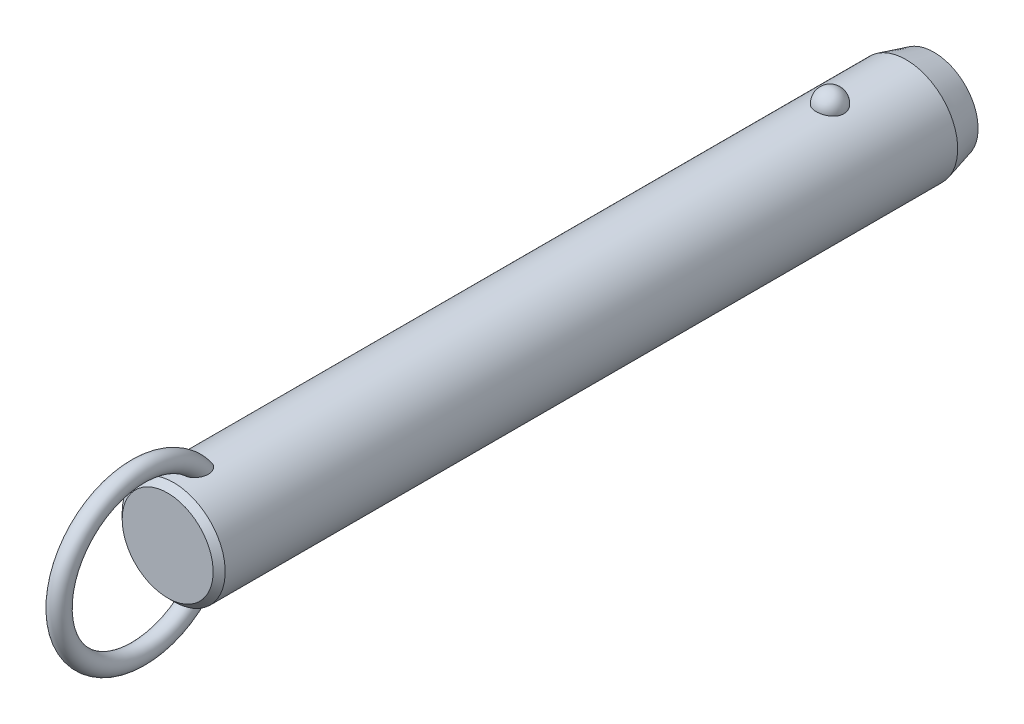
SolidWorks part; units mm, degrees
ref_plane "Front Plane" through (0, 0, 0) normal (0, 0, 1) x (1, 0, 0)
ref_plane "Top Plane" through (0, 0, 0) normal (0, 1, 0) x (1, 0, 0)
ref_plane "Right Plane" through (0, 0, 0) normal (1, 0, 0) x (0, 0, -1)
sketch "Sketch2" plane through (0, 0, 0) normal (0, 0, 1) x (1, 0, 0)
  circle A0 centre (0, 0) radius 11.1
  point P3 (0, 11.1)
  dimension "D1" = 22.2
extrude "Boss-Extrude1" add sketch "Sketch2" along normal blind 127
sketch "Sketch3" plane through (0, 0, 0) normal (0, 0, -1) x (-1, 0, 0)
  circle A0 centre (0, 0) radius 11.1
  dimension "D1" = 22.2
extrude "Boss-Extrude2" add sketch "Sketch3" along normal blind 25.4
chamfer "Chamfer1" distance 6 angle 15 1 edges at (-11.1, 0, -25.4)
sketch "Sketch12" plane through (0, 0, 0) normal (1, 0, 0) x (0, 0, -1)
  line L0 (-127, 11.1) -> (-127, -11.1) construction
  point P0 (-127, 0)
sketch "Sketch13" plane through (0, 0, 0) normal (1, 0, 0) x (0, 0, -1)
  circle A0 centre (-146.05, 0) radius 19.05
  point P2 (-127, 0)
  dimension "D1" = 38.1
sketch "Sketch14" plane through (0, 0, 0) normal (0, 1, 0) x (1, 0, 0)
  circle A0 centre (0, -129) radius 2
  point P2 (0, -127)
  dimension "D1" = 4
sweep "Sweep1" add profiles "Sketch14" path "Sketch13"
sketch "Sketch15" plane through (0, 0, 127) normal (0, 0, 1) x (1, 0, 0)
  circle A0 centre (0, 0) radius 11.1
  dimension "D1" = 22.2
extrude "Boss-Extrude3" add sketch "Sketch15" along normal blind 12.7
chamfer "Chamfer2" distance 1.3 angle 45 1 edges at (11.1, 0, 139.7)
sketch "Sketch18" plane through (0, 0, 0) normal (1, 0, 0) x (0, 0, -1)
  line L0 (19.4, 11.1) -> (-130.568, 11.1) construction
  line L1 (3, 14.1) -> (3, 8.1)
  line L2 (-130.568, -11.1) -> (19.4, -11.1) construction
  arc A0 (3, 14.1) -> (3, 8.1) centre (3, 11.1) ccw
  point P4 (0, 11.1)
  dimension "D1" = 25.2
revolve "Revolve1" add sketch "Sketch18" angle 360 about L1
